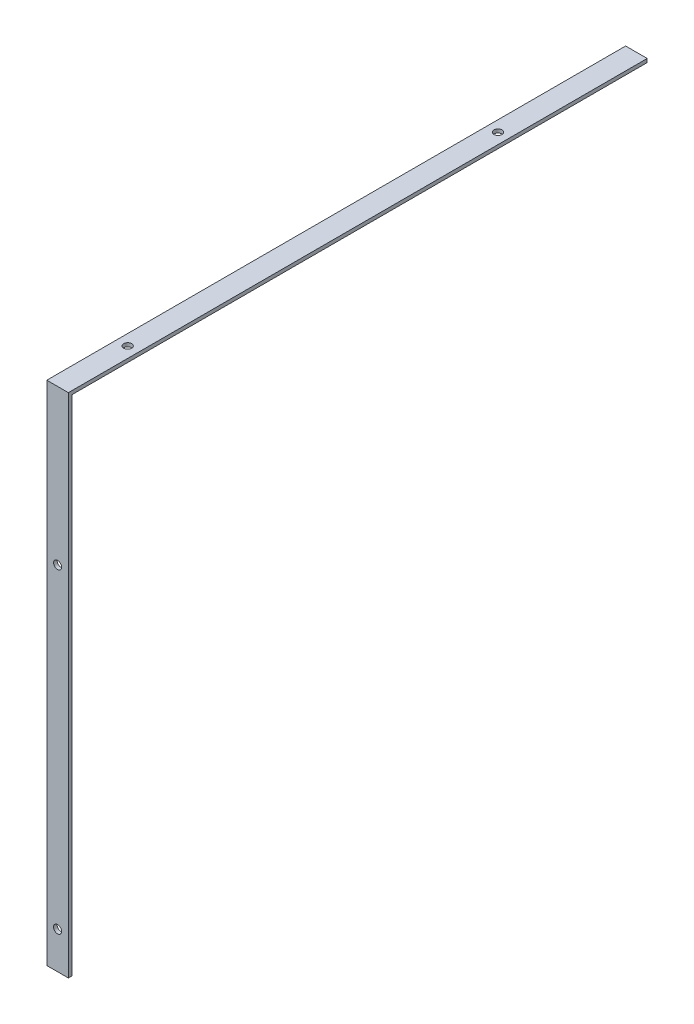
SolidWorks part; units mm, degrees
ref_plane "Front Plane" through (0, 0, 0) normal (0, 0, 1) x (1, 0, 0)
ref_plane "Top Plane" through (0, 0, 0) normal (0, 1, 0) x (1, 0, 0)
ref_plane "Right Plane" through (0, 0, 0) normal (1, 0, 0) x (0, 0, -1)
sketch "Sketch1" plane through (0, 0, 0) normal (1, 0, 0) x (0, 0, -1)
  line L0 (0, 0) -> (-406.4, 0)
  line L1 (-406.4, 0) -> (-406.4, -355.6)
  dimension "D1" = 406.4
  dimension "D2" = 355.6
extrude "Extrude-Thin1" add sketch "Sketch1" along normal blind 15.24 thin
sketch "Sketch2" plane through (0, 0, 0) normal (0, -1, 0) x (1, 0, 0)
  line L0 (15.24, 0) -> (0, 0) construction
  line L1 (15.24, 406.4) -> (0, 406.4) construction
  circle A0 centre (7.62, 97.79) radius 2.8575
  circle A1 centre (7.62, 359.41) radius 2.8321
  dimension "D1" = 5.715
  dimension "D2" = 5.6642
  dimension "D3" = 97.79
  dimension "D4" = 46.99
extrude "Cut-Extrude1" cut sketch "Sketch2" against normal blind 2.54
sketch "Sketch3" plane through (0, 0, 406.4) normal (0, 0, -1) x (-1, 0, 0)
  line L0 (-15.24, 0) -> (0, 0) construction
  circle A0 centre (-7.62, -329.5635) radius 2.8321
  circle A1 centre (-7.62, -106.68) radius 2.8321
  dimension "D1" = 5.6642
  dimension "D2" = 5.6642
  dimension "D3" = 106.68
extrude "Cut-Extrude2" cut sketch "Sketch3" against normal blind 2.54
